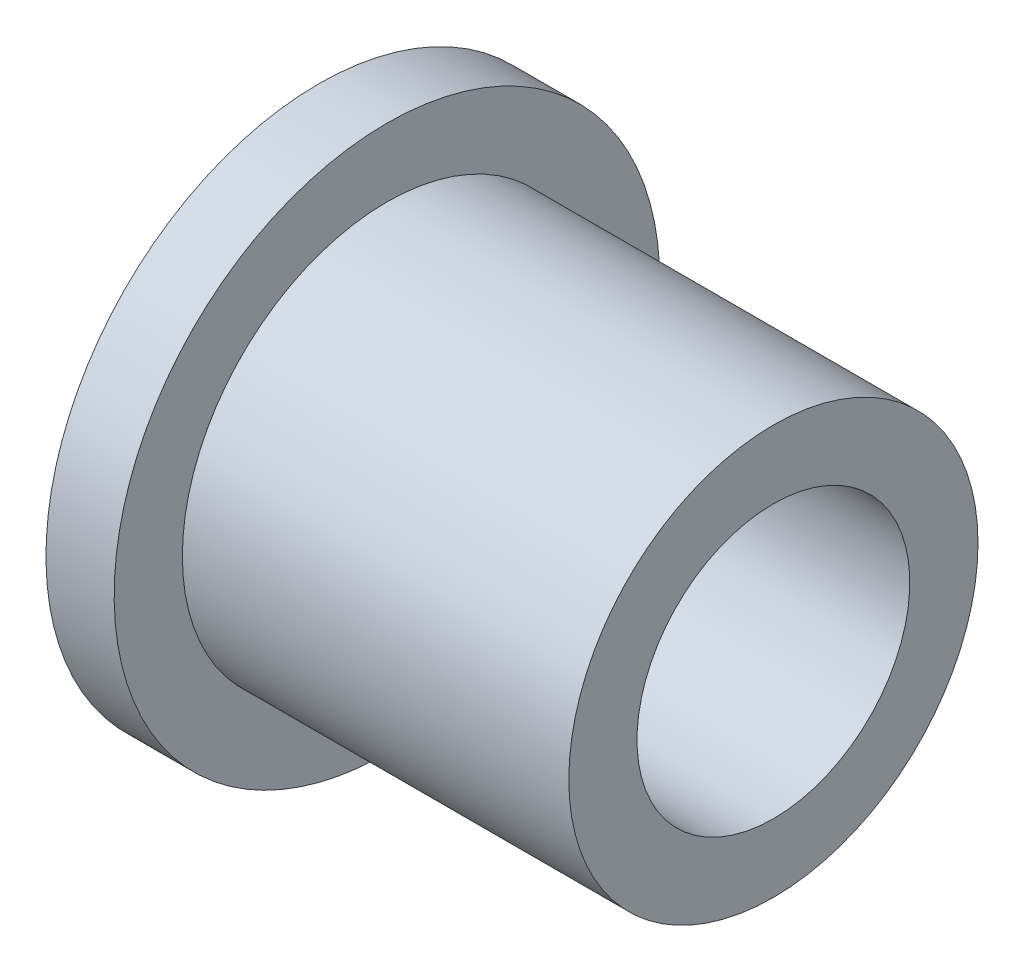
SolidWorks part; units mm, degrees
ref_plane "Piano frontale" through (0, 0, 0) normal (0, 0, 1) x (1, 0, 0)
ref_plane "Piano superiore" through (0, 0, 0) normal (0, 1, 0) x (1, 0, 0)
ref_plane "Piano destro" through (0, 0, 0) normal (1, 0, 0) x (0, 0, -1)
sketch "Schizzo1" plane through (0, 0, 0) normal (0, 0, 1) x (1, 0, 0)
  line L0 (0, 0) -> (-20, 0) construction
  line L1 (-20, 6) -> (-20, 12)
  line L2 (-20, 12) -> (-17, 12)
  line L3 (-17, 12) -> (-17, 9)
  line L4 (-17, 9) -> (0, 9)
  line L5 (0, 9) -> (0, 6)
  line L6 (0, 6) -> (-20, 6)
  point P10 (-18.5, 12)
  dimension "D1" = 12
  dimension "D2" = 3
  dimension "D3" = 17
  dimension "D4" = 3
  dimension "D5" = 24
revolve "Rivoluzione1" add sketch "Schizzo1" angle 360 about L0
sketch "Linee di piegatura1" [suppressed] plane through (0, 0, 0) normal (0, 1, 0) x (1, 0, 0)
sketch "Casella di contorno1" [suppressed] plane through (0, 0, 0) normal (0, 1, 0) x (1, 0, 0)
equation "\"Lam_vern\"= 2 * ( \"SW-Massa\" / \"SW-Densità\" ) / ( \"Spessore\" / 1000 )"
